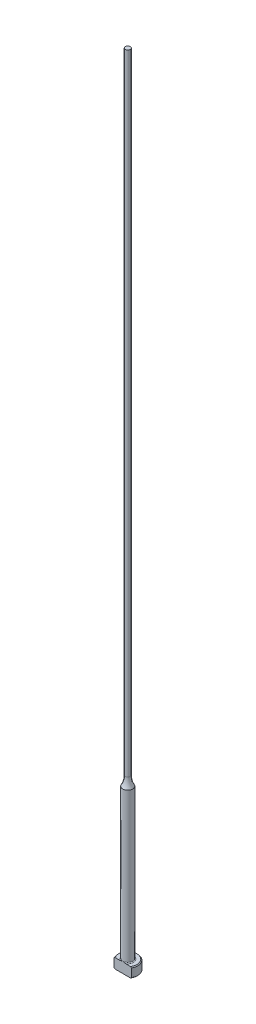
SolidWorks part; units mm, degrees
ref_plane "Front Plane" through (0, 0, 0) normal (0, 0, 1) x (1, 0, 0)
ref_plane "Top Plane" through (0, 0, 0) normal (0, 1, 0) x (1, 0, 0)
ref_plane "Right Plane" through (0, 0, 0) normal (1, 0, 0) x (0, 0, -1)
sketch "Sketch1" plane through (0, 0, 0) normal (0, 0, 1) x (1, 0, 0)
  line L0 (0, 259.9588) -> (0, -15.1925) construction
  line L1 (0, 0) -> (-3.175, 0)
  line L2 (-3.175, 0) -> (-3.175, 3.175)
  line L3 (-3.175, 3.175) -> (-1.5875, 3.175)
  line L4 (-0.7937, 53.8742) -> (-0.7937, 254)
  line L5 (-0.7937, 254) -> (0, 254)
  line L6 (0, 254) -> (0, 0)
  line L7 (-1.5875, 3.175) -> (-1.5875, 50.8)
  arc A0 (-1.5875, 50.8) -> (-0.7937, 53.8742) centre (-7.1437, 53.8742) ccw
  point P13 (-1.5875, 0)
  dimension "D1" = 6.35
  dimension "L" = 254
  dimension "D2" = 3.175
  dimension "H" = 6.35
  dimension "T" = 3.175
  dimension "D" = 1.5875
  dimension "S" = 50.8
revolve "Revolve1" add sketch "Sketch1" angle 360 about L0
chamfer "Chamfer1" distance 0.254 angle 45 2 edges at (0, 3.175, 3.175) (0, 0, 3.175)
fillet "Fillet1" radius 0.254 1 edges at (0, 3.175, 1.5875)
sketch "Sketch2" plane through (0, 0, 0) normal (0, -1, 0) x (1, 0, 0)
  line L0 (-2.7496, 1.5875) -> (2.7496, 1.5875)
  arc A0 (2.7496, 1.5875) -> (-2.7496, 1.5875) centre (0, 0) ccw
  circle A1 centre (0, 0) radius 3.175 construction
  circle A2 centre (0, 0) radius 1.5875 construction
extrude "Cut-Extrude1" cut sketch "Sketch2" against normal through all
